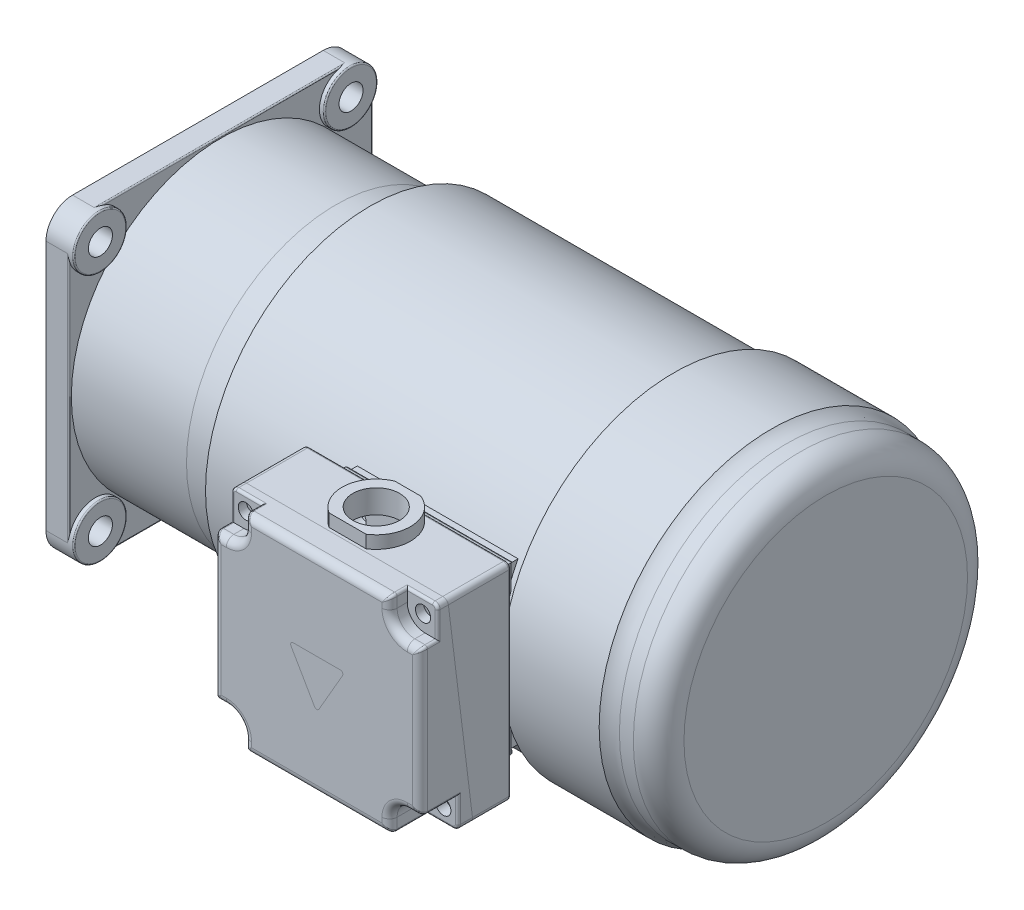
SolidWorks part; units mm, degrees
ref_plane "前视基准面" through (0, 0, 0) normal (0, 0, 1) x (1, 0, 0)
ref_plane "上视基准面" through (0, 0, 0) normal (0, 1, 0) x (1, 0, 0)
ref_plane "右视基准面" through (0, 0, 0) normal (1, 0, 0) x (0, 0, -1)
imported_body "接线盒座-1-surface1"
imported_body "接线盒座-1-surface2"
imported_body "接线盒座-1-surface3"
imported_body "接线盒座-1-surface4"
imported_body "接线盒座-1-surface5"
imported_body "接线盒座-1-surface6"
imported_body "接线盒座-1-surface7"
imported_body "接线盒盖-1-surface1"
imported_body "接线盒盖-1-surface2"
imported_body "接线盒盖-1-surface3"
imported_body "接线盒盖-1-surface4"
imported_body "15.11.08 18B立式装配体200-1-surface1"
imported_body "15.11.08 18B立式装配体200-1-surface2"
imported_body "15.11.08 18B立式装配体200-1-surface3"
imported_body "15.11.08 18B立式装配体200-1-surface4"
imported_body "15.11.08 18B立式装配体200-1-surface5"
imported_body "15.11.08 18B立式装配体200-1-surface6"
imported_body "15.11.08 18B立式装配体200-1-surface7"
imported_body "15.11.08 18B立式装配体200-1-surface8"
imported_body "GB／T1096-1979普通平键A型5×25-1-surface1"
sketch "草图1" plane through (-67.9473, 0, 0) normal (1, 0, 0) x (0, 0, -1)
  circle A0 centre (4.61, -126.4756) radius 65
  circle A1 centre (4.61, -142.9652) radius 16.4896 construction
extrude "凸台-拉伸1" add sketch "草图1" along normal blind 120
sketch "草图2" plane through (52.0527, 0, 0) normal (1, 0, 0) x (0, 0, -1)
  circle A0 centre (4.61, -126.4756) radius 68
extrude "凸台-拉伸2" add sketch "草图2" along normal blind 38.5
sketch "草图3" plane through (90.5527, 0, 0) normal (1, 0, 0) x (0, 0, -1)
  circle A0 centre (4.61, -126.4756) radius 66
extrude "凸台-拉伸3" add sketch "草图3" along normal blind 21.5
fillet "圆角1" radius 10 1 edges at (112.0527, -126.4756, -70.61)
fillet "圆角2" radius 10 1 edges at (90.5527, -126.4756, -70.61)
